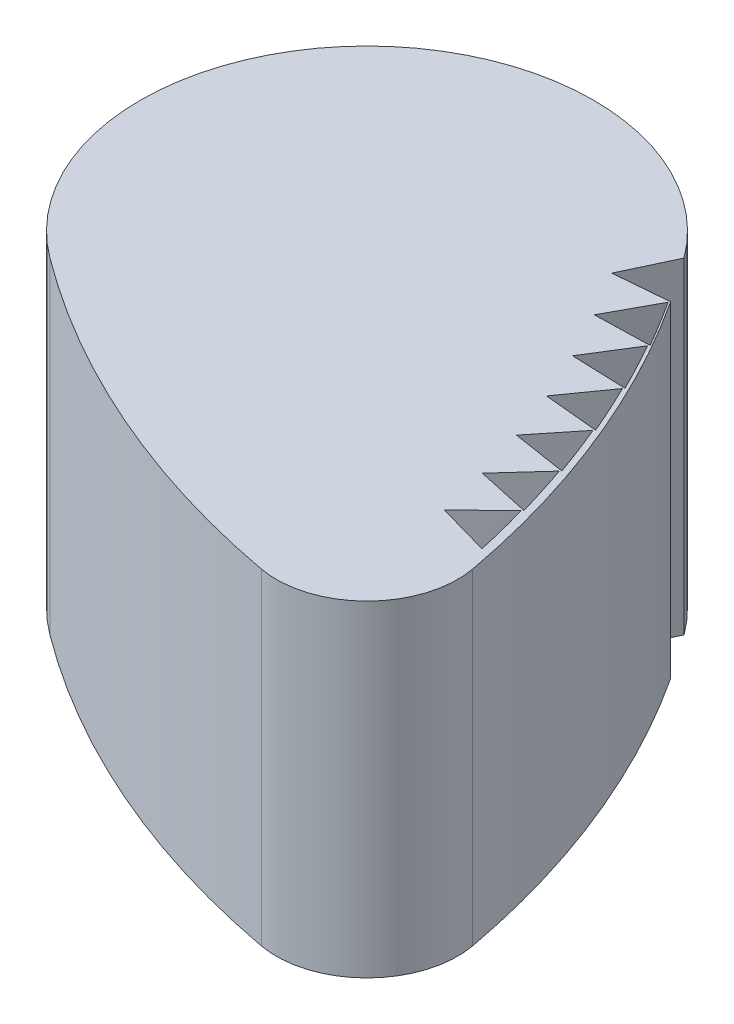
SolidWorks part; units mm, degrees
ref_plane "Ebene vorne" through (0, 0, 0) normal (0, 0, 1) x (1, 0, 0)
ref_plane "Ebene oben" through (0, 0, 0) normal (0, 1, 0) x (1, 0, 0)
ref_plane "Ebene rechts" through (0, 0, 0) normal (1, 0, 0) x (0, 0, -1)
sketch "Skizze1" plane through (0, 0, 0) normal (0, 1, 0) x (1, 0, 0)
  line L2 (0, 0) -> (14.1421, -14.1421) construction
  line L3 (0, 0) -> (0, 12.5) construction
  arc A0 (10.0333, 7.4553) -> (-7.4553, -10.0333) centre (0, 0) ccw
  arc A1 (13.2284, -19.0579) -> (19.0579, -13.2284) centre (14.1421, -14.1421) ccw
  arc A2 (10.0333, 7.4553) -> (19.0579, -13.2284) centre (-30.1, -22.366) cw
  arc A3 (-7.4553, -10.0333) -> (13.2284, -19.0579) centre (22.366, 30.1) ccw
  dimension "D1" = 25
  dimension "D3" = 5
  dimension "D4" = 50
  dimension "D2" = 20
  dimension "D5" = 45
extrude "Aufsatz-Linear austragen1" add sketch "Skizze1" along normal blind 18
sketch "Skizze2" plane through (0, 18, 0) normal (0, 1, 0) x (1, 0, 0)
  arc A0 (19.0579, -13.2284) -> (10.0333, 7.4553) centre (-30.1, -22.366) ccw construction
  arc A1 (13.2284, -19.0579) -> (19.0579, -13.2284) centre (14.1421, -14.1421) ccw construction
  arc A2 (-7.4553, -10.0333) -> (13.2284, -19.0579) centre (22.366, 30.1) ccw construction
  arc A3 (19.0579, -13.2284) -> (10.0333, 7.4553) centre (-30.1, -22.366) ccw
  arc A4 (13.2284, -19.0579) -> (19.0579, -13.2284) centre (14.1421, -14.1421) ccw
  arc A5 (-7.4553, -10.0333) -> (13.2284, -19.0579) centre (22.366, 30.1) ccw
sketch "Skizze3" plane through (0, 18, 0) normal (0, 1, 0) x (1, 0, 0)
  line L0 (10.0333, 7.4553) -> (8.7605, 4.7387)
  line L1 (8.7605, 4.7387) -> (11.7496, 4.9947)
  line L2 (8.7605, 4.7387) -> (10.9099, 6.2379) construction
  arc A0 (19.0579, -13.2284) -> (10.0333, 7.4553) centre (-30.1, -22.366) ccw construction
  arc A1 (11.7496, 4.9947) -> (10.0333, 7.4553) centre (-30.1, -22.366) ccw
  dimension "D1" = 3
  dimension "D2" = 60
extrude "Schnitt-Linear austragen1" cut sketch "Skizze3" against normal through all
pattern_curve "Kurvenmuster1" of "Schnitt-Linear austragen1" parameters "D1"=8, "D3"=3, "D2"=1, "D4"=1
